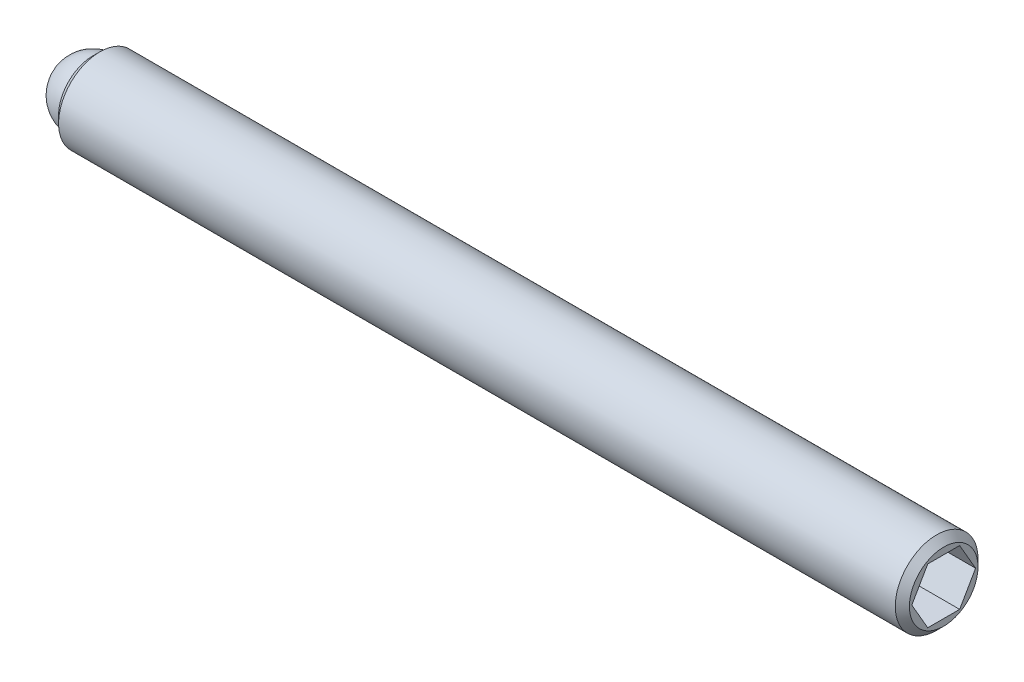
SolidWorks part; units mm, degrees
ref_plane "Front Plane" through (0, 0, 0) normal (0, 0, 1) x (1, 0, 0)
ref_plane "Top Plane" through (0, 0, 0) normal (0, 1, 0) x (1, 0, 0)
ref_plane "Right Plane" through (0, 0, 0) normal (1, 0, 0) x (0, 0, -1)
sketch "Sketch2" plane through (0, 0, 0) normal (1, 0, 0) x (0, 0, -1)
  circle A0 centre (0, 0) radius 1.4859
  dimension "D1" = 2.9718
extrude "Boss-Extrude1" add sketch "Sketch2" along normal blind 30.5594
sketch "Sketch3" plane through (0, 0, 0) normal (-1, 0, 0) x (0, 0, 1)
  circle A0 centre (0, 0) radius 1.1906
  dimension "D1" = 2.3813
chamfer "Chamfer1" distance 0.254 angle 45 1 edges at (0, 0, -1.4859)
chamfer "Chamfer2" distance 0.254 angle 45 1 edges at (30.5594, 0, -1.4859)
sketch "Sketch4" plane through (30.5594, 0, 0) normal (1, 0, 0) x (0, 0, -1)
  line L1 (1.1457, 0) -> (0.5728, 0.9922)
  line L2 (0.5728, 0.9922) -> (-0.5728, 0.9922)
  line L3 (-0.5728, 0.9922) -> (-1.1457, 0)
  line L4 (-1.1457, 0) -> (-0.5728, -0.9922)
  line L5 (-0.5728, -0.9922) -> (0.5728, -0.9922)
  line L6 (0.5728, -0.9922) -> (1.1457, 0)
  circle A0 centre (0, 0) radius 0.9922 construction
extrude "Cut-Extrude2" cut sketch "Sketch4" against normal blind 2.286
extrude "Cut-Extrude3" cut sketch "Sketch3" against normal blind 1.1906
sketch "Sketch5" plane through (0, 0, 0) normal (-1, 0, 0) x (0, 0, 1)
  line L0 (0, 0) -> (0, -1.1906)
  line L1 (0, 0) -> (0, 1.1906)
  arc A0 (0, 1.1906) -> (0, -1.1906) centre (0, 0) ccw
  dimension "D1" = 1.1906
revolve "Revolve1" add sketch "Sketch5" angle 360 about L1
